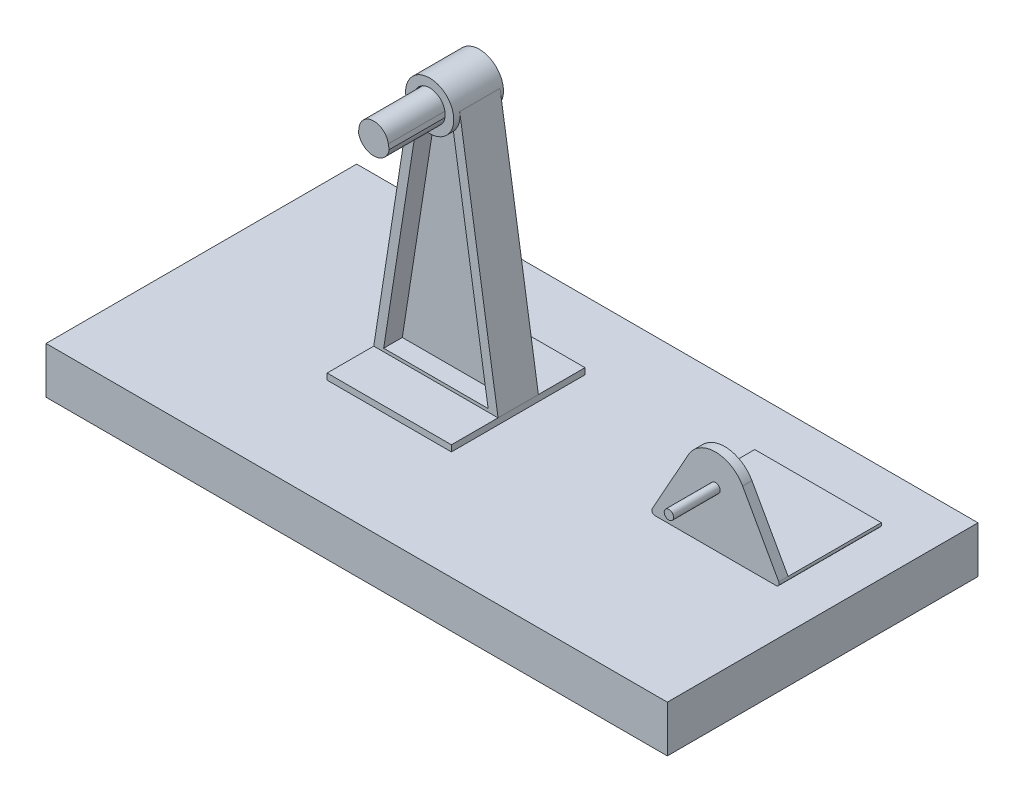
SolidWorks part; units mm, degrees
ref_plane "Plan de face" through (0, 0, 0) normal (0, 0, 1) x (1, 0, 0)
ref_plane "Plan de dessus" through (0, 0, 0) normal (0, 1, 0) x (1, 0, 0)
ref_plane "Plan de droite" through (0, 0, 0) normal (1, 0, 0) x (0, 0, -1)
sketch "Esquisse1" plane through (0, 0, 0) normal (0, 0, 1) x (1, 0, 0)
  line L1 (-100, 7.5) -> (100, 7.5)
  line L2 (-100, 7.5) -> (-100, -7.5)
  line L3 (-100, -7.5) -> (100, -7.5)
  line L4 (100, 7.5) -> (100, -7.5)
  line L5 (-100, 7.5) -> (100, -7.5) construction
  line L6 (-100, -7.5) -> (100, 7.5) construction
  point P0 (0, 0)
  dimension "D1" = 200
  dimension "D2" = 15
extrude "Boss.-Extru.1" add sketch "Esquisse1" along normal mid plane 100
sketch "Esquisse2" plane through (0, 0, 0) normal (0, 0, 1) x (1, 0, 0)
  line L0 (85, 7.5) -> (46, 7.5)
  line L1 (100, 7.5) -> (-100, 7.5) construction
  line L2 (45.1265, 8.9868) -> (56.7651, 29.8685)
  line L3 (74.2349, 29.8685) -> (85.8735, 8.9868)
  line L5 (100, -7.5) -> (100, 7.5) construction
  arc A0 (56.7651, 29.8685) -> (74.2349, 29.8685) centre (65.5, 25) cw
  arc A1 (85, 7.5) -> (85.8735, 8.9868) centre (85, 8.5) ccw
  arc A2 (46, 7.5) -> (45.1265, 8.9868) centre (46, 8.5) cw
  point P7 (0, 0)
  point P8 (65.5, 7.5)
  point P9 (0, 0)
  point P12 (86.7022, 7.5)
  point P15 (44.2978, 7.5)
  dimension "D1" = 10
  dimension "D2" = 1
  dimension "D3" = 15
  dimension "17.5" = 17.5
  dimension "D4" = 39
extrude "Boss.-Extru.2" add sketch "Esquisse2" against normal blind 3
sketch "Esquisse3" plane through (0, 0, -3) normal (0, 0, -1) x (-1, 0, 0)
  line L0 (-45.1265, 8.9868) -> (-85.8735, 8.9868)
  line L1 (-46, 7.5) -> (-85, 7.5) construction
  line L2 (-46, 7.5) -> (-85, 7.5)
  arc A0 (-46, 7.5) -> (-45.1265, 8.9868) centre (-46, 8.5) ccw construction
  arc A1 (-85.8735, 8.9868) -> (-85, 7.5) centre (-85, 8.5) ccw construction
  arc A2 (-46, 7.5) -> (-45.1265, 8.9868) centre (-46, 8.5) ccw
  arc A3 (-85.8735, 8.9868) -> (-85, 7.5) centre (-85, 8.5) ccw
extrude "Boss.-Extru.3" add sketch "Esquisse3" along normal blind 30
sketch "Esquisse4" plane through (0, 0, 0) normal (0, 0, 1) x (1, 0, 0)
  circle A0 centre (65.5, 25) radius 1.5
  arc A1 (74.2349, 29.8685) -> (56.7651, 29.8685) centre (65.5, 25) ccw construction
  dimension "D1" = 3
extrude "Boss.-Extru.4" add sketch "Esquisse4" along normal blind 15
sketch "Esquisse5" plane through (0, 0, 0) normal (0, 0, 1) x (1, 0, 0)
  line L4 (100, 7.5) -> (-100, 7.5) construction
  line L5 (-44.5, 7.5) -> (-4.5, 7.5)
  line L6 (-44.5, 7.5) -> (-44.5, 9.5)
  line L7 (-44.5, 9.5) -> (-4.5, 9.5)
  line L8 (-4.5, 7.5) -> (-4.5, 9.5)
  line L9 (-44.5, 9.5) -> (-32.1576, 88.6934)
  line L10 (-16.8424, 88.6934) -> (-4.5, 9.5)
  circle A0 centre (65.5, 25) radius 1.5 construction
  arc A1 (-32.1576, 88.6934) -> (-16.8424, 88.6934) centre (-24.5, 87.5) cw
  point P6 (-24.5, 7.5)
  point P12 (0, 0)
  point P13 (-24.5, 9.5)
  point P14 (0, 0)
  dimension "D2" = 7.75
  dimension "D1" = 90
  dimension "D3" = 40
  dimension "D4" = 2
  dimension "D5" = 80
extrude "Boss.-Extru.6" add sketch "Esquisse5" against normal blind 13 contours A1 L9 L7 L10 | L5 L8 L7 L6
sketch "Esquisse6" plane through (0, 0, 0) normal (0, 0, 1) x (1, 0, 0)
  line L10 (-29.1933, 88.2315) -> (-41.3079, 10.5)
  line L11 (-41.3079, 10.5) -> (-7.6921, 10.5)
  line L12 (-7.6921, 10.5) -> (-19.8067, 88.2315)
  line L13 (-29.1933, 88.2315) -> (-41.3079, 10.5)
  line L14 (-41.3079, 10.5) -> (-7.6921, 10.5)
  line L15 (-7.6921, 10.5) -> (-19.8067, 88.2315)
  arc A2 (-19.8067, 88.2315) -> (-29.1933, 88.2315) centre (-24.5, 87.5) ccw
  arc A3 (-19.8067, 88.2315) -> (-29.1933, 88.2315) centre (-24.5, 87.5) ccw
  dimension "D1" = 3
extrude "Enlèv. mat.-Extru.1" cut sketch "Esquisse6" against normal blind 6
sketch "Esquisse7" plane through (0, 0, -6) normal (0, 0, 1) x (1, 0, 0)
  circle A0 centre (-24.5, 87.5) radius 5
  circle A1 centre (-24.5, 87.5) radius 7.75
  arc A2 (-16.8424, 88.6934) -> (-32.1576, 88.6934) centre (-24.5, 87.5) ccw construction
  dimension "D1" = 10
extrude "Boss.-Extru.7" add sketch "Esquisse7" along normal blind 8 and the other way blind 8
sketch3d "Esquisse3D1"
  line L0 (-18.3216, 78.7029, -13) -> (-7.6921, 10.5, -13)
  line L1 (-7.6921, 10.5, -13) -> (-41.3079, 10.5, -13)
  line L2 (-41.3079, 10.5, -13) -> (-30.6784, 78.7029, -13)
  line L3 (-18.3216, 78.7029, -13) -> (-7.6921, 10.5, -13)
  line L4 (-7.6921, 10.5, -13) -> (-41.3079, 10.5, -13)
  line L5 (-41.3079, 10.5, -13) -> (-30.6784, 78.7029, -13)
  spline S0 degree 5 poles (2796.3888, -891.4899, -13) (1129.7045, -149.4927, -13) (270.5977, 147.5498, -13) (-37.7718, 170.5497, -13) (-52.4551, 89.2475, -13) (-28.9895, 77.7215, -13) (-28.6444, 77.5703, -13) (-27.942, 77.2985, -13) (-27.2184, 77.0892, -13) (-26.8523, 77.0004, -13) (-26.1132, 76.855, -13) (-25.3643, 76.7749, -13) (-24.9883, 76.7512, -13) (-24.2352, 76.7368, -13) (-23.4838, 76.7883, -13) (-23.1094, 76.8304, -13) (-22.3653, 76.9472, -13) (-21.6343, 77.1288, -13) (-21.273, 77.2355, -13) (-20.5606, 77.4801, -13) (-19.8723, 77.7861, -13) (-19.5351, 77.9541, -13) (3.335, 90.6197, -13) (-15.3264, 171.0983, -13) (-322.2607, 133.0214, -13) (-1165.935, -205.7207, -13) (-2794.5438, -1028.399, -12.9994) knots -9.686161 -9.686161 -9.686161 -9.686161 -9.686161 -9.686161 0.09136 0.09136 0.09136 0.234268 0.234268 0.234268 0.377177 0.377177 0.377177 0.520085 0.520085 0.520085 0.662994 0.662994 0.662994 0.805902 0.805902 0.805902 0.94881 0.94881 0.94881 10.726143 10.726143 10.726143 10.726143 10.726143 10.726143 only from (-30.6784, 78.7029, -13) to (-18.3216, 78.7029, -13)
  spline S1 degree 5 poles (-30.6784, 78.7029, -13) (-30.4815, 78.5646, -13) (-30.2808, 78.4319, -13) (-30.0765, 78.3048, -13) (-29.5436, 77.9937, -13) (-28.9895, 77.7215, -13) (-28.6444, 77.5703, -13) (-27.942, 77.2985, -13) (-27.2184, 77.0892, -13) (-26.8523, 77.0004, -13) (-26.1132, 76.855, -13) (-25.3643, 76.7749, -13) (-24.9883, 76.7512, -13) (-24.2352, 76.7368, -13) (-23.4838, 76.7883, -13) (-23.1094, 76.8304, -13) (-22.3653, 76.9472, -13) (-21.6343, 77.1288, -13) (-21.273, 77.2355, -13) (-20.5606, 77.4801, -13) (-19.8723, 77.7861, -13) (-19.5351, 77.9541, -13) (-19.0876, 78.2019, -13) (-18.6561, 78.4757, -13) (-18.5434, 78.5497, -13) (-18.4319, 78.6254, -13) (-18.3216, 78.7029, -13) knots 0 0 0 0 0 0 0.09136 0.09136 0.09136 0.234268 0.234268 0.234268 0.377177 0.377177 0.377177 0.520085 0.520085 0.520085 0.662994 0.662994 0.662994 0.805902 0.805902 0.805902 0.94881 0.94881 0.94881 1 1 1 1 1 1
  dimension "D1" = 3
extrude "Enlèv. mat.-Extru.2" cut sketch "Esquisse3D1" along direction (0, 0, 1) on the side of the normal blind 6 contours L3 L4 L5 S1
sketch "Esquisse10" plane through (0, 0, -6) normal (0, 0, 1) x (1, 0, 0)
  line L2 (-29.1933, 88.2315) -> (-29.4338, 86.6888)
  line L3 (-19.5662, 86.6888) -> (-19.8067, 88.2315)
  line L4 (-29.1933, 88.2315) -> (-29.4338, 86.6888)
  line L5 (-19.5662, 86.6888) -> (-19.8067, 88.2315)
  arc A2 (-29.4338, 86.6888) -> (-19.5662, 86.6888) centre (-24.5, 87.5) ccw
  arc A3 (-19.8067, 88.2315) -> (-29.1933, 88.2315) centre (-24.5, 87.5) ccw
  arc A4 (-29.4338, 86.6888) -> (-19.5662, 86.6888) centre (-24.5, 87.5) ccw
  arc A5 (-19.8067, 88.2315) -> (-29.1933, 88.2315) centre (-24.5, 87.5) ccw
  dimension "D1" = 0
extrude "Boss.-Extru.8" add sketch "Esquisse10" along normal blind 26
sketch "Esquisse11" plane through (0, 0, 0) normal (0, 0, 1) x (1, 0, 0)
  line L1 (-44.5, 9.5) -> (-4.5, 9.5)
  line L2 (-44.5, 9.5) -> (-44.5, 7.5)
  line L3 (-44.5, 7.5) -> (-4.5, 7.5)
  line L4 (-4.5, 9.5) -> (-4.5, 7.5)
extrude "Boss.-Extru.9" add sketch "Esquisse11" along normal blind 15
sketch "Esquisse12" plane through (0, 0, -13) normal (0, 0, -1) x (-1, 0, 0)
  line L1 (4.5, 7.5) -> (44.5, 7.5)
  line L2 (4.5, 7.5) -> (4.5, 9.5)
  line L3 (4.5, 9.5) -> (44.5, 9.5)
  line L4 (44.5, 7.5) -> (44.5, 9.5)
extrude "Boss.-Extru.10" add sketch "Esquisse12" along normal blind 15
